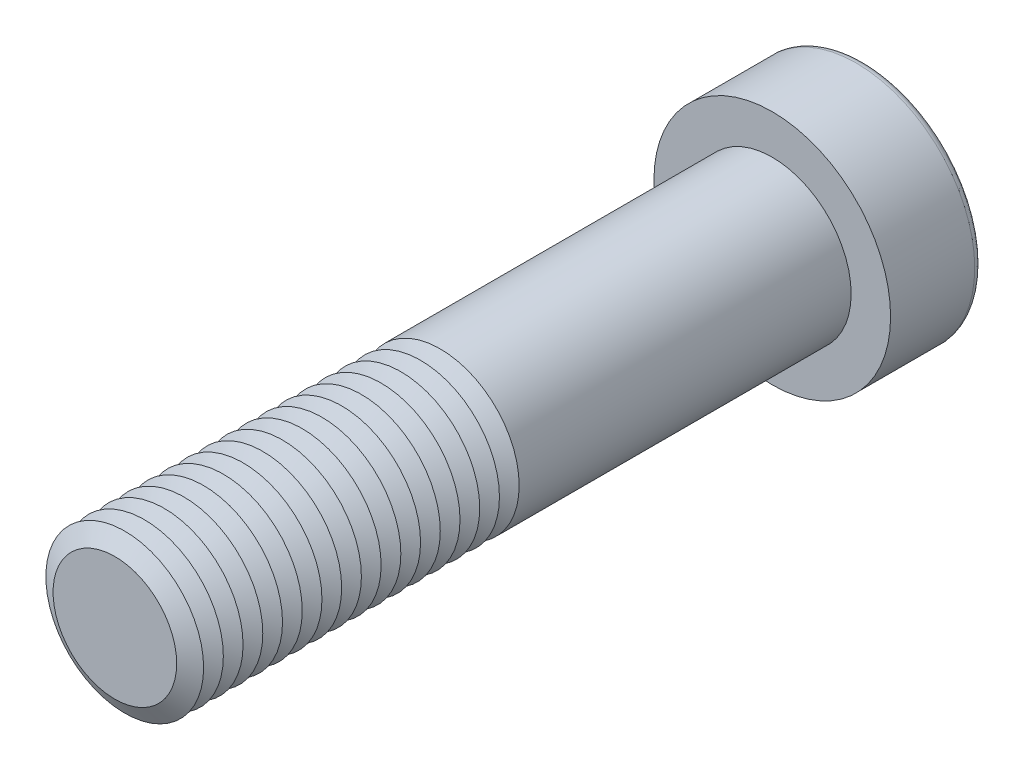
SolidWorks part; units mm, degrees
ref_plane "Front Plane" through (0, 0, 0) normal (0, 0, 1) x (1, 0, 0)
ref_plane "Top Plane" through (0, 0, 0) normal (0, 1, 0) x (1, 0, 0)
ref_plane "Right Plane" through (0, 0, 0) normal (1, 0, 0) x (0, 0, -1)
sketch "Sketch1" plane through (0, 0, 0) normal (0, 0, 1) x (1, 0, 0)
  circle A0 centre (0, 0) radius 12
  dimension "D1" = 24
extrude "Boss-Extrude1" add sketch "Sketch1" along normal blind 100
sketch "Sketch2" plane through (0, 0, 0) normal (0, 0, -1) x (-1, 0, 0)
  circle A0 centre (0, 0) radius 18
  dimension "D1" = 36
extrude "Boss-Extrude2" add sketch "Sketch2" along normal blind 14
sketch "Sketch3" plane through (0, 0, -14) normal (0, 0, -1) x (-1, 0, 0)
  line L1 (-5.4848, 9.5) -> (-10.9697, 0)
  line L2 (-10.9697, 0) -> (-5.4848, -9.5)
  line L3 (-5.4848, -9.5) -> (5.4848, -9.5)
  line L4 (5.4848, -9.5) -> (10.9697, 0)
  line L5 (10.9697, 0) -> (5.4848, 9.5)
  line L6 (5.4848, 9.5) -> (-5.4848, 9.5)
  circle A0 centre (0, 0) radius 9.5 construction
  dimension "D1" = 19
extrude "Cut-Extrude1" cut sketch "Sketch3" against normal blind 14.25
fillet "Fillet1" radius 1.2 1 edges at (-18, 0, -14)
sketch "Sketch4" plane through (0, 0, 0.25) normal (0, 0, -1) x (-1, 0, 0)
  line L0 (5.4848, -9.5) -> (10.9697, 0) construction
  circle A0 centre (0, 0) radius 9.5
extrude "Cut-Extrude2" cut sketch "Sketch4" against normal through all draft 60
sketch "Sketch5" plane through (0, 0, -14) normal (0, 0, -1) x (-1, 0, 0)
  circle A0 centre (0, 0) radius 10.9697
extrude "Cut-Extrude3" cut sketch "Sketch5" against normal through all draft 75
sketch "Sketch7" plane through (0, 0, 0) normal (1, 0, 0) x (0, 0, -1)
  line L25 (-100, 9.4019) -> (-98.5, 12)
  line L26 (-100, 12) -> (-100, -12) construction
  line L27 (-98.5, 12) -> (-101.5, 12)
  line L28 (-101.5, 12) -> (-100, 9.4019)
  line L29 (0, 12) -> (-100, 12) construction
  dimension "D1" = 3
revolve "Cut-Revolve1" cut sketch "Sketch7" angle 360 about axis through (0, 0, 100) along (0, 0, -1)
pattern_linear "LPattern1" count 17 spacing 3 along (0, 0, -1) of "Cut-Revolve1"
